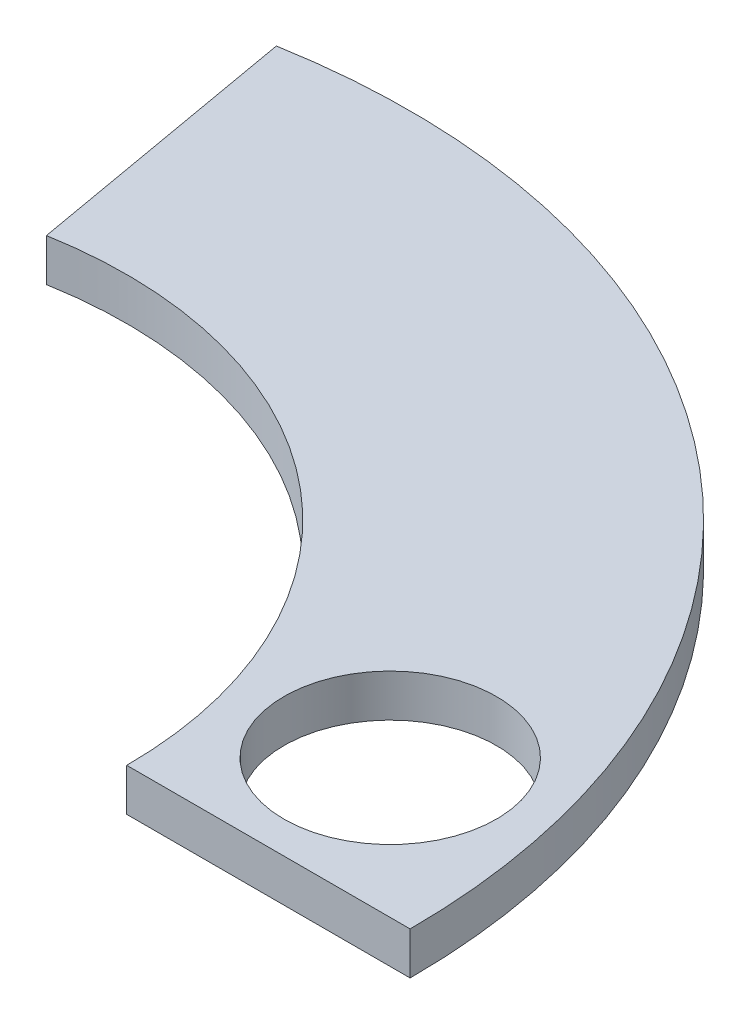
SolidWorks part; units mm, degrees
ref_plane "Front Plane" through (0, 0, 0) normal (0, 0, 1) x (1, 0, 0)
ref_plane "Top Plane" through (0, 0, 0) normal (0, 1, 0) x (1, 0, 0)
ref_plane "Right Plane" through (0, 0, 0) normal (1, 0, 0) x (0, 0, -1)
sketch "Sketch1" plane through (0, 0, 0) normal (0, 1, 0) x (1, 0, 0)
  line L0 (0, 50) -> (0, 0)
  line L1 (0, 0) -> (50, 0)
  line L2 (5, 5) -> (48.7415, 11.1475) construction
  line L3 (0, 0) -> (-8.6824, 49.2404)
  circle A0 centre (0, 0) radius 50
  circle A1 centre (0, 0) radius 30
  circle A2 centre (38.8388, 9.7557) radius 7.5
  circle A3 centre (5, 5) radius 1.5
  dimension "D1" = 100
  dimension "D3" = 5
  dimension "D5" = 3
  dimension "D8" = 15
  dimension "D2" = 20
  dimension "D4" = 5
  dimension "D6" = 8
  dimension "D7" = 10
  dimension "D9" = 10
extrude "Boss-Extrude1" add sketch "Sketch1" along normal blind 3 contours A1 L1 A0 L0 | A2 L2 A1 L1 A0 | A1 L0 A0 L3
